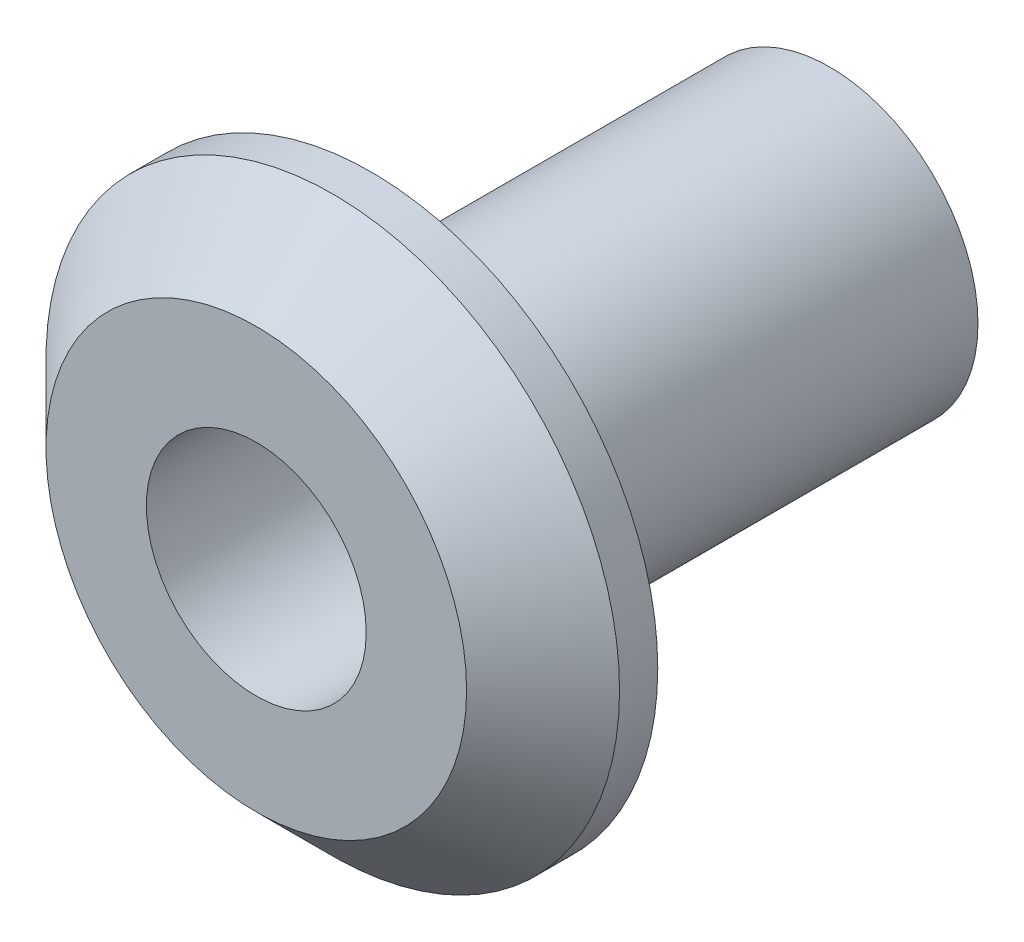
SolidWorks part; units mm, degrees
ref_plane "Alzado" through (0, 0, 0) normal (0, 0, 1) x (1, 0, 0)
ref_plane "Planta" through (0, 0, 0) normal (0, 1, 0) x (1, 0, 0)
ref_plane "Vista lateral" through (0, 0, 0) normal (1, 0, 0) x (0, 0, -1)
sketch "Croquis1" plane through (0, 0, 0) normal (0, 0, 1) x (1, 0, 0)
  circle A0 centre (0, 0) radius 7.5
  circle A1 centre (0, 0) radius 1.55
  dimension "D1" = 15
  dimension "D2" = 3.1
extrude "Saliente-Extruir1" add sketch "Croquis1" along normal mid plane 3
chamfer "Chaflán1" distance 2 angle 45 1 edges at (7.5, 0, 1.5)
sketch "Croquis2" plane through (0, 0, -1.5) normal (0, 0, -1) x (-1, 0, 0)
  circle A2 centre (0, 0) radius 1.55 construction
  circle A3 centre (0, 0) radius 1.55
  circle A4 centre (0, 0) radius 3.875
  dimension "D1" = 7.75
extrude "Saliente-Extruir2" add sketch "Croquis2" along normal blind 12
sketch "Croquis3" plane through (0, 0, 1.5) normal (0, 0, 1) x (1, 0, 0)
  circle A0 centre (0, 0) radius 2.875
  dimension "D1" = 5.75
extrude "Cortar-Extruir1" cut sketch "Croquis3" against normal offset from surface (12 mm away) 3
